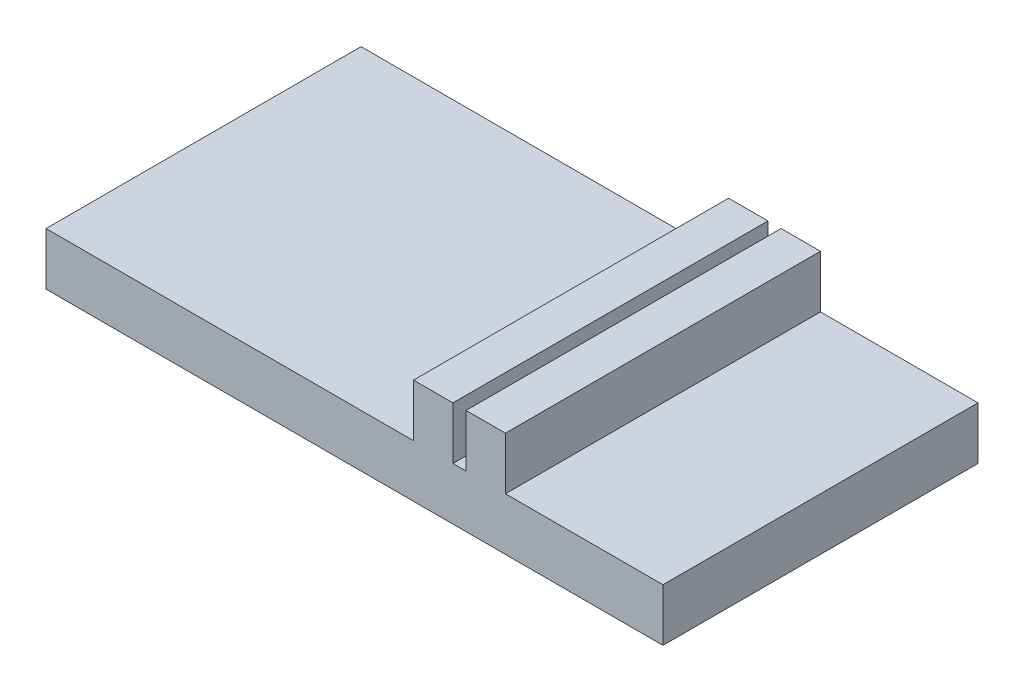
SolidWorks part; units mm, degrees
ref_plane "Front Plane" through (0, 0, 0) normal (0, 0, 1) x (1, 0, 0)
ref_plane "Top Plane" through (0, 0, 0) normal (0, 1, 0) x (1, 0, 0)
ref_plane "Right Plane" through (0, 0, 0) normal (1, 0, 0) x (0, 0, -1)
sketch "Sketch1" plane through (0, 0, 0) normal (0, 0, 1) x (1, 0, 0)
  line L0 (0, 0) -> (298.45, 0)
  line L1 (298.45, 0) -> (298.45, 25.4)
  line L2 (298.45, 25.4) -> (222.25, 25.4)
  line L3 (222.25, 25.4) -> (222.25, 50.8)
  line L4 (222.25, 50.8) -> (203.2, 50.8)
  line L5 (203.2, 50.8) -> (203.2, 25.4)
  line L6 (203.2, 25.4) -> (196.85, 25.4)
  line L7 (196.85, 25.4) -> (196.85, 50.8)
  line L8 (196.85, 50.8) -> (177.8, 50.8)
  line L9 (177.8, 50.8) -> (177.8, 25.4)
  line L10 (177.8, 25.4) -> (0, 25.4)
  line L11 (0, 25.4) -> (0, 0)
  dimension "D1" = 25.4
  dimension "D2" = 25.4
  dimension "D3" = 298.45
  dimension "D4" = 25.4
  dimension "D5" = 76.2
  dimension "D6" = 19.05
  dimension "D7" = 25.4
  dimension "D8" = 19.05
  dimension "D9" = 177.8
extrude "Boss-Extrude1" add sketch "Sketch1" along normal blind 152.4
